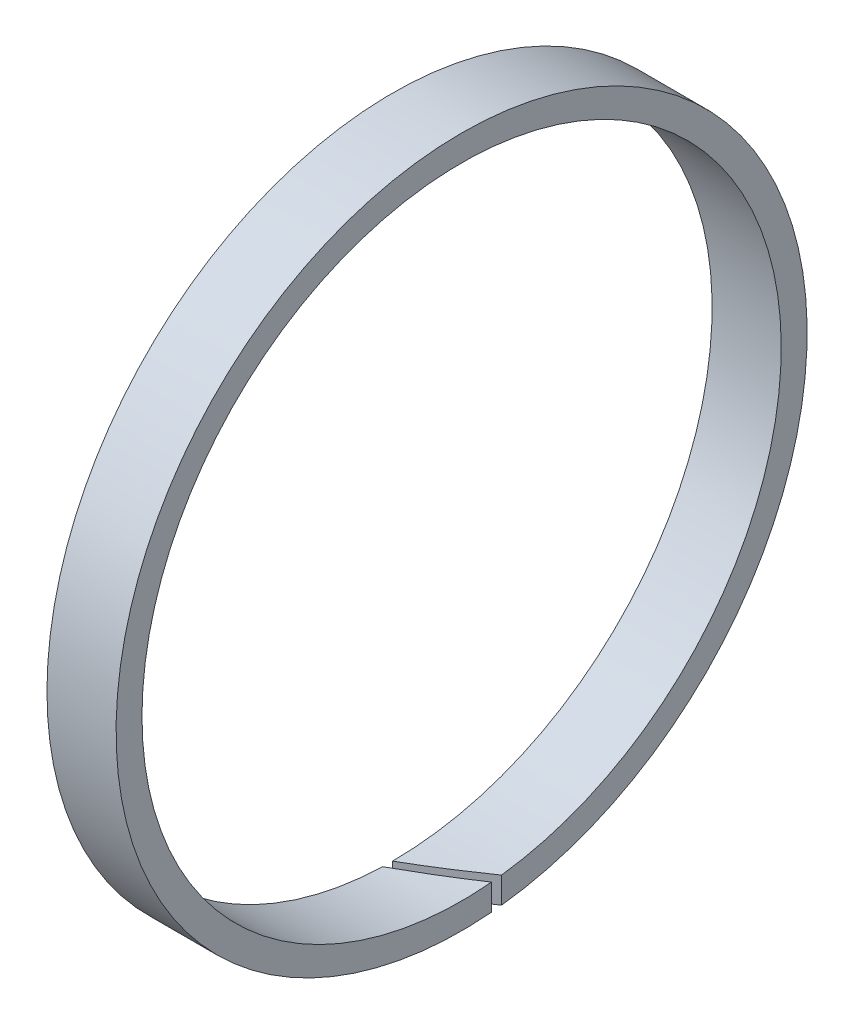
SolidWorks part; units mm, degrees
ref_plane "Face" through (0, 0, 0) normal (0, 0, 1) x (1, 0, 0)
ref_plane "Dessus" through (0, 0, 0) normal (0, 1, 0) x (1, 0, 0)
ref_plane "Droite" through (0, 0, 0) normal (1, 0, 0) x (0, 0, -1)
sketch "Esquisse1" plane through (0, 0, 0) normal (0, 0, 1) x (1, 0, 0)
  line L0 (0, 18.5) -> (4, 18.5)
  line L1 (4, 18.5) -> (4, 20)
  line L2 (4, 20) -> (0, 20)
  line L3 (0, 20) -> (0, 18.5)
  line L4 (0, 0) -> (10.827, 0) construction
  dimension "D1" = 1.5
  dimension "D2" = 4
  dimension "D3" = 37
revolve "Révolution1" add sketch "Esquisse1" angle 360 about L4
sketch "Esquisse2" plane through (0, 0, 0) normal (0, 1, 0) x (1, 0, 0)
  line L0 (0, 0) -> (4, 2.3094)
  line L1 (4, -20) -> (4, 20) construction
  line L2 (4, 2.3094) -> (4, 1.7321)
  line L3 (4, 1.7321) -> (0, -0.5774)
  line L4 (0, 20) -> (0, -20) construction
  line L5 (0, -0.5774) -> (0, 0)
  line L6 (0, 0) -> (13.8216, 0) construction
  dimension "D1" = 0.5
  dimension "D2" = 30
extrude "Enlèv. mat.-Extru.1" cut sketch "Esquisse2" against normal through all
